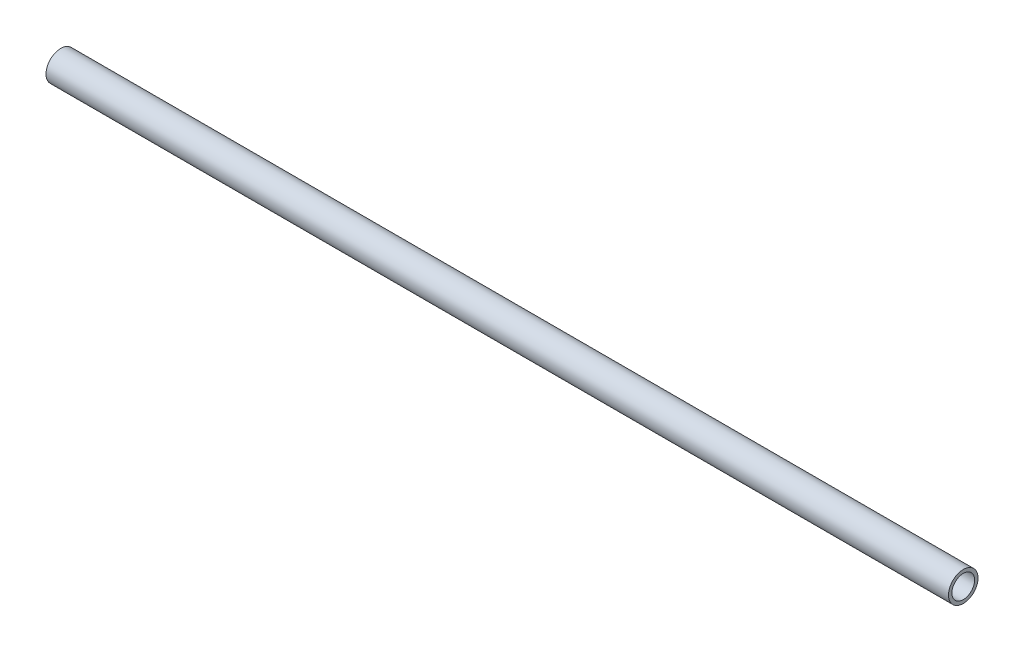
SolidWorks part; units mm, degrees
ref_plane "Front" through (0, 0, 0) normal (0, 0, 1) x (1, 0, 0)
ref_plane "Top" through (0, 0, 0) normal (0, 1, 0) x (1, 0, 0)
ref_plane "Right" through (0, 0, 0) normal (1, 0, 0) x (0, 0, -1)
sketch "Sketch1" plane through (0, 0, 0) normal (0, 0, 1) x (1, 0, 0)
  line L0 (0, 0) -> (1009.65, 0)
  line L1 (9.9848, 0) -> (-9.9848, 0) construction
  dimension "D1" = 1009.65
other "Structural Member1"
ref_plane "Plane1" through (0, 0, 0) normal (1, 0, 0) x (0, 0, -1)
sketch "Sketch11" plane through (0, 0, 0) normal (1, 0, 0) x (0, 0, -1)
  circle A0 centre (0, 0) radius 12.7
  circle A1 centre (0, 0) radius 16.51
  point P3 (0, 0)
  dimension "D1" = 33.02
  dimension "D2" = 25.4
